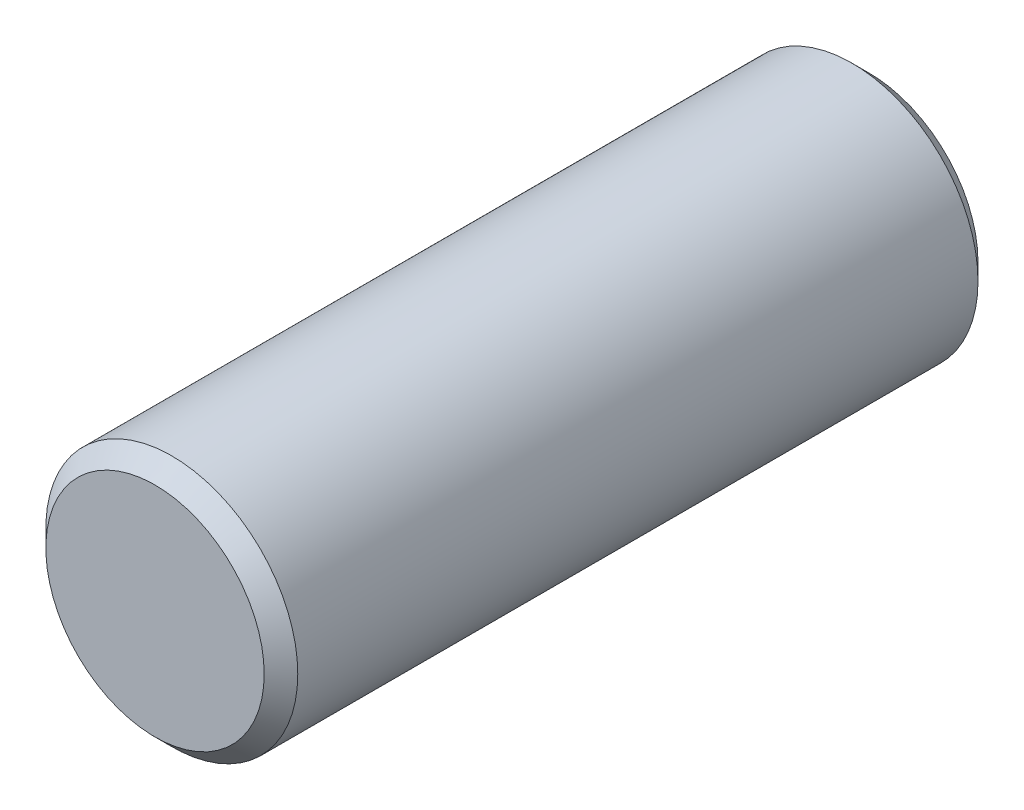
SolidWorks part; units mm, degrees
ref_plane "Ön Düzlem" through (0, 0, 0) normal (0, 0, 1) x (1, 0, 0)
ref_plane "Üst Düzlem" through (0, 0, 0) normal (0, 1, 0) x (1, 0, 0)
ref_plane "Sağ Düzlem" through (0, 0, 0) normal (1, 0, 0) x (0, 0, -1)
sketch "Çizim1" plane through (0, 0, 0) normal (0, 0, 1) x (1, 0, 0)
  circle A0 centre (0, 0) radius 15
extrude "Yükseklik-Ekstrüzyon1" add sketch "Çizim1" along normal blind 85
chamfer "Pah1" distance 2 angle 45 2 edges at (15, 0, 0) (15, 0, 85)
